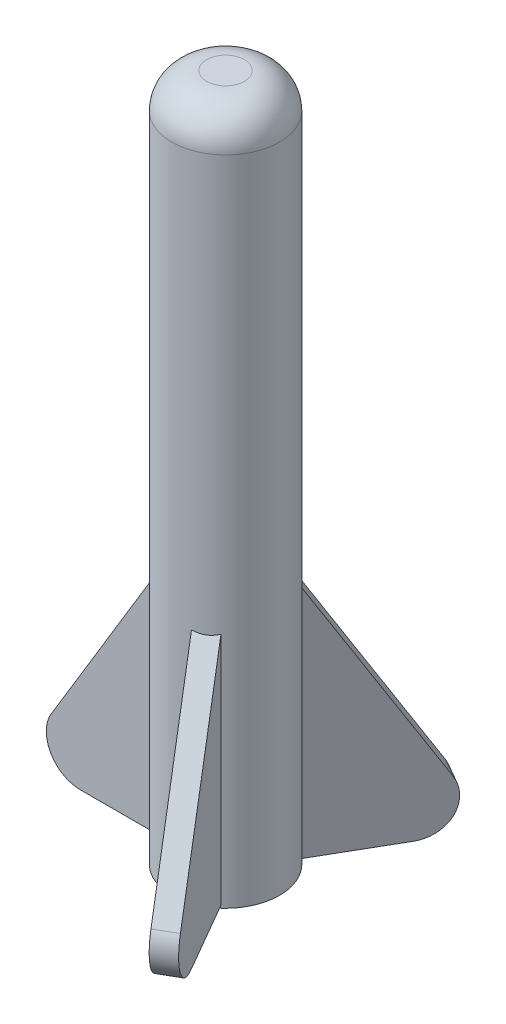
SolidWorks part; units mm, degrees
ref_plane "Front" through (0, 0, 0) normal (0, 0, 1) x (1, 0, 0)
ref_plane "Top" through (0, 0, 0) normal (0, 1, 0) x (1, 0, 0)
ref_plane "Right" through (0, 0, 0) normal (1, 0, 0) x (0, 0, -1)
sketch "Sketch1" plane through (0, 0, 0) normal (0, 1, 0) x (1, 0, 0)
  circle A0 centre (0, 0) radius 5.08
  dimension "D1" = 10.16
extrude "Base-Extrude" add sketch "Sketch1" along normal blind 64.77
fillet "Fillet1" radius 3.302 1 edges at (0, 64.77, 5.08)
sketch "Sketch4" plane through (0, 0, 0) normal (0, 0, 1) x (1, 0, 0)
  line L3 (-2.794, 0) -> (0, 0)
  line L4 (0, 33.0835) -> (-2.794, 33.0835)
  line L5 (-2.794, 33.0835) -> (-2.794, 0)
  line L6 (0, 0) -> (0, 33.0835)
  line L8 (0, 33.0835) -> (0, 42.847) construction
  dimension "D1" = 5.588
  dimension "D2" = 33.0835
revolve "Cut-Revolve1" cut sketch "Sketch4" angle 360 about L8
sketch "Sketch3" plane through (0, 0, 0) normal (0, 0, 1) x (1, 0, 0)
  line L0 (-4.826, 0.254) -> (-12.7, 0.254)
  line L1 (-15.4177, 5.0705) -> (-4.826, 22.606)
  line L2 (-4.826, 22.606) -> (-4.826, 0.254)
  line L3 (-5.08, 61.468) -> (-5.08, 0) construction
  line L4 (5.08, 0) -> (-5.08, 0) construction
  arc A0 (-12.7, 0.254) -> (-15.4177, 5.0705) centre (-12.7, 3.429) cw
  dimension "D2" = 3.175
  dimension "D1" = 0.254
  dimension "D3" = 0.254
  dimension "D4" = 22.352
  dimension "D5" = 7.62
extrude "Boss-Extrude1" add sketch "Sketch3" along normal mid plane 2.032
pattern_circular "CirPattern1" count 3 over 360 about axis through (0, 0, 0) along (0, 1, 0) of "Boss-Extrude1"
